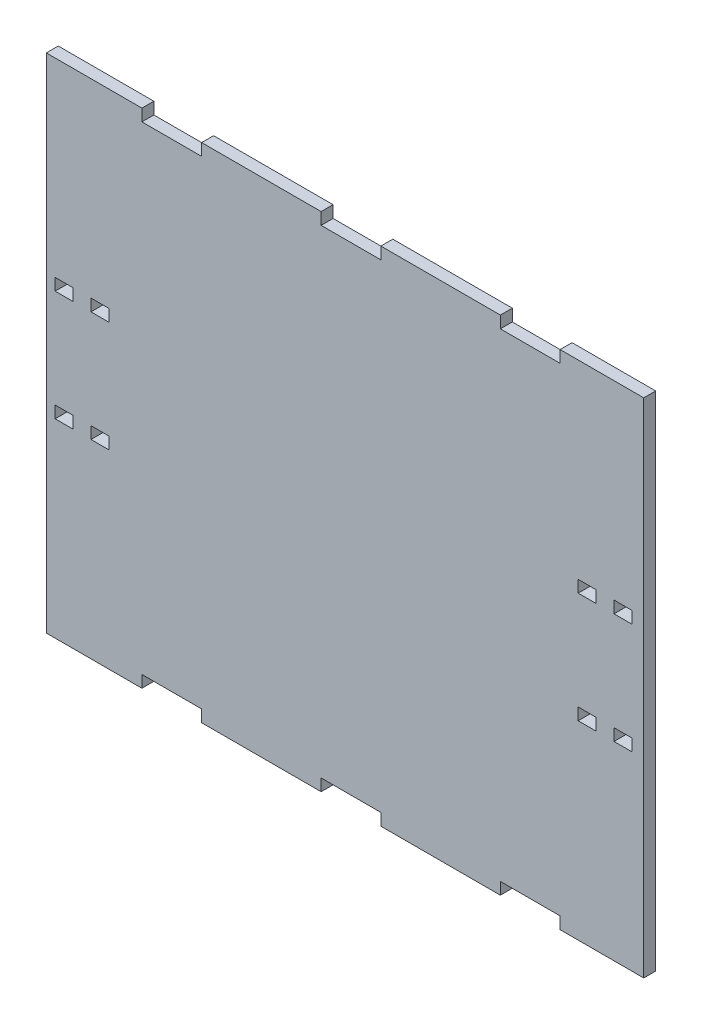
SolidWorks part; units mm, degrees
ref_plane "Piano frontale" through (0, 0, 0) normal (0, 0, 1) x (1, 0, 0)
ref_plane "Piano superiore" through (0, 0, 0) normal (0, 1, 0) x (1, 0, 0)
ref_plane "Piano destro" through (0, 0, 0) normal (1, 0, 0) x (0, 0, -1)
sketch "Schizzo1" plane through (0, 0, 0) normal (0, 0, 1) x (1, 0, 0)
  line L2 (-500, -420.5) -> (-500, 420.5)
  line L4 (500, -420.5) -> (500, 420.5)
  line L5 (-500, 420.5) -> (500, 420.5)
  line L7 (-500, -420.5) -> (500, -420.5)
  point P0 (0, 0)
  point P1 (0, 0)
  point P2 (0, 0)
  dimension "D1" = 500
  dimension "D2" = 500
  dimension "D3" = 420.5
  dimension "D4" = 420.5
extrude "Estrusione-Estrusione1" add sketch "Schizzo1" along normal blind 20
sketch3d "Schizzo3D1"
  line L0 (480.2639, -82.4986, 0) -> (450.2639, -82.4986, 0)
  line L1 (450.2639, -82.4986, 0) -> (450.2639, -102.4986, 0)
  line L2 (450.2639, -102.4986, 0) -> (480.2639, -102.4986, 0)
  line L3 (480.2639, -102.4986, 0) -> (480.2639, -82.4986, 0)
  line L4 (420.2639, -82.4986, 0) -> (390.2639, -82.4986, 0)
  line L5 (-425.2324, 102.5078, 0) -> (-455.2324, 102.5078, 0) construction
  line L6 (390.2639, -82.4986, 0) -> (390.2639, -102.4986, 0)
  line L7 (-395.2324, 82.5078, 0) -> (-425.2324, 82.5078, 0)
  line L8 (390.2639, -102.4986, 0) -> (420.2639, -102.4986, 0)
  line L9 (420.2639, -102.4986, 0) -> (420.2639, -82.4986, 0)
  line L10 (450.2639, 82.5078, 0) -> (420.2639, 82.5078, 0) construction
  line L11 (-395.2324, 82.5078, 0) -> (-395.2324, 102.5078, 0)
  line L12 (450.2639, 102.5078, 0) -> (390.2639, 102.5078, 0) construction
  line L13 (-395.2324, 102.5078, 0) -> (-425.2324, 102.5078, 0)
  line L14 (-425.2324, 82.5078, 0) -> (-425.2324, 102.5078, 0)
  line L15 (420.2639, 82.5078, 0) -> (390.2639, 82.5078, 0)
  line L16 (450.2639, 82.5078, 0) -> (480.2639, 82.5078, 0)
  line L17 (480.2639, 82.5078, 0) -> (480.2639, 102.5078, 0)
  line L18 (480.2639, 102.5078, 0) -> (450.2639, 102.5078, 0)
  line L19 (450.2639, 102.5078, 0) -> (450.2639, 82.5078, 0)
  line L20 (-485.2324, -102.4986, 0) -> (-455.2324, -102.4986, 0)
  line L21 (-425.2324, 82.5078, 0) -> (-485.2324, 82.5078, 0) construction
  line L22 (-455.2324, -102.4986, 0) -> (-455.2324, -82.4986, 0)
  line L23 (-455.2324, -82.4986, 0) -> (-485.2324, -82.4986, 0)
  line L25 (-485.2324, -82.4986, 0) -> (-485.2324, -102.4986, 0)
  line L26 (-395.2324, -82.4986, 0) -> (-425.2324, -82.4986, 0)
  line L27 (-425.2324, -82.4986, 0) -> (-425.2324, -102.4986, 0)
  line L28 (-425.2324, -102.4986, 0) -> (-395.2324, -102.4986, 0)
  line L29 (-395.2324, -102.4986, 0) -> (-395.2324, -82.4986, 0)
  line L30 (420.2639, 82.5078, 0) -> (420.2639, 102.5078, 0)
  line L31 (420.2639, 102.5078, 0) -> (390.2639, 102.5078, 0)
  line L32 (390.2639, 82.5078, 0) -> (390.2639, 102.5078, 0)
  line L33 (-395.2324, 82.5078, 0) -> (-395.2324, 102.5078, 0) construction
  line L34 (-455.2324, 102.5078, 0) -> (-485.2324, 102.5078, 0)
  line L35 (-455.2324, 102.5078, 0) -> (-455.2324, 82.5078, 0)
  line L36 (-455.2324, 82.5078, 0) -> (-485.2324, 82.5078, 0)
  line L37 (-485.2324, 102.5078, 0) -> (-485.2324, 82.5078, 0)
extrude "Taglio-Estrusione1" cut sketch "Schizzo3D1" along direction (0, 0, 1) on the side of the normal through all
sketch "Schizzo2" plane through (0, 0, 0) normal (0, 0, -1) x (-1, 0, 0)
  line L0 (-360, -400.5) -> (-260, -400.5) construction
  line L1 (-260, -400.5) -> (-260, -420.5) construction
  line L2 (500, -420.5) -> (-500, -420.5) construction
  line L3 (-260, -420.5) -> (-260, -400.5) construction
  line L4 (-260, -420.5) -> (-360, -420.5) construction
  line L5 (-360, -420.5) -> (-360, -400.5) construction
  line L6 (-360, -420.5) -> (-360, -400.5) construction
  line L7 (-60, -400.5) -> (40, -400.5) construction
  line L8 (40, -400.5) -> (40, -420.5) construction
  line L9 (40, -420.5) -> (40, -400.5) construction
  line L10 (40, -420.5) -> (-60, -420.5) construction
  line L11 (-60, -420.5) -> (-60, -400.5) construction
  line L12 (-60, -420.5) -> (-60, -400.5) construction
  line L13 (240, -400.5) -> (340, -400.5) construction
  line L14 (340, -400.5) -> (340, -420.5) construction
  line L15 (340, -420.5) -> (340, -400.5) construction
  line L16 (340, -420.5) -> (240, -420.5) construction
  line L17 (240, -420.5) -> (240, -400.5) construction
  line L18 (340, 400.51) -> (240, 400.51) construction
  line L19 (240, 400.51) -> (240, 420.5) construction
  line L20 (-500, 420.5) -> (500, 420.5) construction
  line L21 (240, 400.51) -> (240, 420.51) construction
  line L22 (240, 420.5) -> (340, 420.5) construction
  line L23 (340, 420.5) -> (340, 400.51) construction
  line L24 (0, 0) -> (-500, 0) construction
  line L25 (-500, -420.5) -> (-500, 420.5) construction
sketch "Schizzo3" plane through (0, 0, 0) normal (0, 0, -1) x (-1, 0, 0)
  line L1 (340, 420.5) -> (240, 420.5)
  line L2 (340, 420.5) -> (340, 400.51)
  line L3 (340, 400.51) -> (240, 400.51)
  line L4 (240, 420.5) -> (240, 400.51)
  line L5 (340, -400.5) -> (240, -400.5)
  line L6 (340, -400.5) -> (340, -420.5)
  line L7 (340, -420.5) -> (240, -420.5)
  line L8 (240, -400.5) -> (240, -420.5)
extrude "Taglio-Estrusione2" cut sketch "Schizzo3" against normal blind 20
pattern_linear "Ripetizione a L1" count 3 spacing 300 along (1, 0, 0) of "Taglio-Estrusione2"
